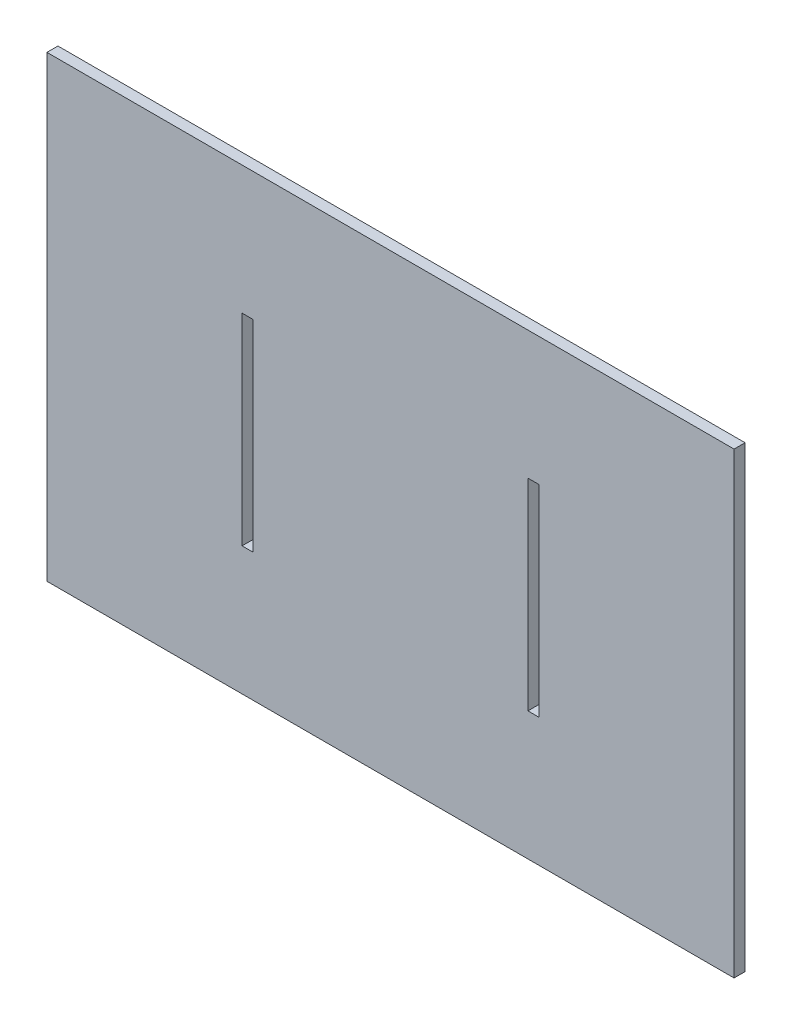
SolidWorks part; units mm, degrees
ref_plane "Front Plane" through (0, 0, 0) normal (0, 0, 1) x (1, 0, 0)
ref_plane "Top Plane" through (0, 0, 0) normal (0, 1, 0) x (1, 0, 0)
ref_plane "Right Plane" through (0, 0, 0) normal (1, 0, 0) x (0, 0, -1)
sketch "Sketch1" plane through (0, 0, 0) normal (0, 0, 1) x (1, 0, 0)
  line L1 (0, 0) -> (750, 0)
  line L2 (0, 0) -> (0, 500)
  line L3 (0, 500) -> (750, 500)
  line L4 (750, 0) -> (750, 500)
  dimension "D1" = 750
  dimension "D2" = 500
extrude "Boss-Extrude1" add sketch "Sketch1" along normal blind 12
sketch "Sketch2" plane through (0, 0, 12) normal (0, 0, 1) x (1, 0, 0)
  line L0 (375, 500) -> (375, 0) construction
  line L1 (213, 360) -> (225, 360)
  line L2 (213, 360) -> (213, 140)
  line L3 (213, 140) -> (225, 140)
  line L4 (225, 360) -> (225, 140)
  line L5 (525, 360) -> (537, 360)
  line L6 (525, 360) -> (525, 140)
  line L7 (525, 140) -> (537, 140)
  line L8 (537, 360) -> (537, 140)
  line L9 (750, 500) -> (0, 500) construction
  line L10 (0, 0) -> (750, 0) construction
  line L11 (0, 500) -> (0, 0) construction
  line L12 (750, 0) -> (750, 500) construction
  dimension "D1" = 12
  dimension "D2" = 12
  dimension "D3" = 220
  dimension "D4" = 220
  dimension "D5" = 150
  dimension "D6" = 150
  dimension "D7" = 213
  dimension "D8" = 213
  dimension "D9" = 140
  dimension "D10" = 140
  dimension "D11" = 140
  dimension "D12" = 140
extrude "Cut-Extrude1" cut sketch "Sketch2" against normal blind 14
